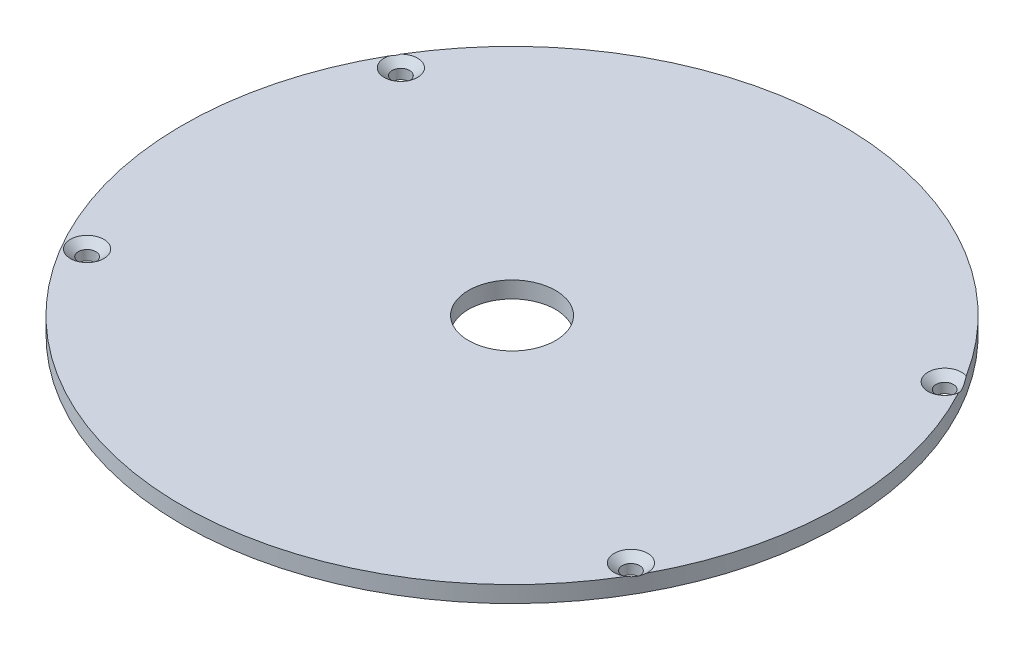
SolidWorks part; units mm, degrees
ref_plane "Front Plane" through (0, 0, 0) normal (0, 0, 1) x (1, 0, 0)
ref_plane "Top Plane" through (0, 0, 0) normal (0, 1, 0) x (1, 0, 0)
ref_plane "Right Plane" through (0, 0, 0) normal (1, 0, 0) x (0, 0, -1)
sketch "Sketch1" plane through (0, 0, 0) normal (0, 1, 0) x (1, 0, 0)
  circle A0 centre (0, 0) radius 127
extrude "Extrude1" add sketch "Sketch1" along normal blind 6.35
sketch "Sketch2" plane through (0, 6.35, 0) normal (0, 1, 0) x (-1, 0, 0)
  circle A0 centre (0, 0) radius 16.764
extrude "Cut-Extrude1" cut sketch "Sketch2" against normal blind 6.35
hole_wizard "CSK for 1/4 Flat Head Machine Screw (100)1" positions "3DSketch3" profile "Sketch5" countersink size "1/4" standard "Ansi Inch"
sketch3d "3DSketch3"
  point P0 (105.4905, 6.35, -61.2297)
  point P2 (105.4905, 6.35, 59.6743)
  point P4 (-104.0595, 6.35, 59.6743)
  point P6 (-104.0595, 6.35, -61.2297)
  dimension "D1" = 120.904
  dimension "D2" = 209.55
  dimension "D3" = 120.904
sketch "Sketch5" plane through (105.4905, 6.35, -61.2297) normal (1, 0, 0) x (0, 0, 1)
  line L0 (0, 0) -> (0, 6.35)
  line L1 (0, 6.35) -> (3.3782, 6.35)
  line L2 (3.3782, 6.35) -> (3.3782, 2.5682)
  line L3 (3.3782, 2.5682) -> (6.4389, 0)
  line L5 (6.4389, 0) -> (0, 0)
  line L6 (-3.3782, 2.5682) -> (-6.4389, 0) construction
  line L11 (0, -6.35) -> (0, 107.95) construction
  dimension "Thru Hole Dia." = 6.7564
  dimension "Thru Hole Depth" = 6.35
  dimension "Near C'Sink Dia." = 12.8778
  dimension "Near C'Sink Angle" = 100
